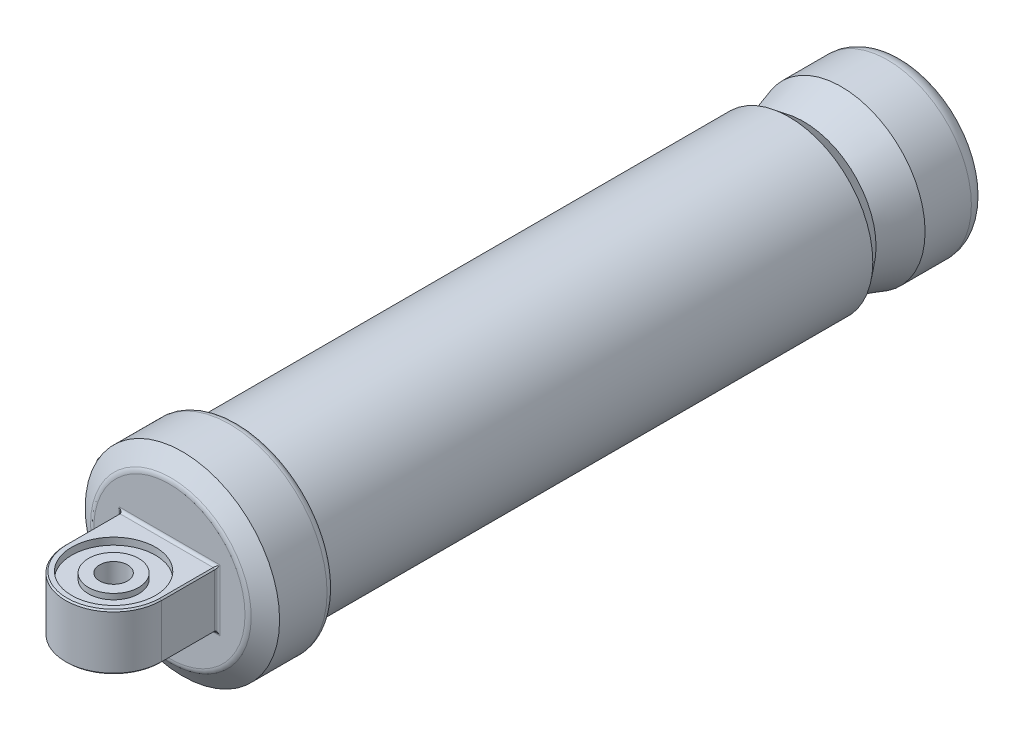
SolidWorks part; units mm, degrees
ref_plane "Front Plane" through (0, 0, 0) normal (0, 0, 1) x (1, 0, 0)
ref_plane "Top Plane" through (0, 0, 0) normal (0, 1, 0) x (1, 0, 0)
ref_plane "Right Plane" through (0, 0, 0) normal (1, 0, 0) x (0, 0, -1)
imported_body "Imported6"
sketch "Sketch1" plane through (0, 0, 66.8352) normal (0, 0, -1) x (-1, 0, 0)
  line L0 (34.5157, -4.5) -> (34.5157, 4.5)
  line L1 (34.5157, 4.5) -> (44.5, 4.5) construction
  arc A0 (34.5157, 4.5) -> (34.5157, -4.5) centre (0, 0) ccw
  dimension "D1" = 34.8078
  dimension "D2" = 9.9843
  dimension "D3" = 44.5
extrude "Cut-Extrude1" cut sketch "Sketch1" against normal blind 11.4794
sketch "Sketch2" plane through (-34.5157, 0, 0) normal (1, 0, 0) x (0, 0, -1)
  line L0 (-66.8352, -4.5) -> (-66.8352, 4.5)
  line L1 (-66.8352, 4.5) -> (-78.3146, 4.5)
  line L2 (-78.3146, 4.5) -> (-78.3146, -4.5)
  line L3 (-78.3146, -4.5) -> (-66.8352, -4.5)
  line L4 (-66.8352, 4.5) -> (-78.3146, 4.5) construction
  dimension "D1" = 11.4794
  dimension "D2" = 9
extrude "Cut-Extrude2" cut sketch "Sketch2" against normal blind 0.9843
sketch "Sketch3" plane through (0, 0, 78.3146) normal (0, 0, -1) x (-1, 0, 0)
  line L0 (35.5, -4.5) -> (34.5157, -4.5) construction
  circle A0 centre (0, 0) radius 34.8078
  dimension "D1" = 69.6157
  dimension "D2" = 35.5
  dimension "D3" = 4.5
extrude "Boss-Extrude1" add sketch "Sketch3" along normal blind 3.187
ref_plane "Plane1" through (0, -10, 0) normal (0, -1, 0) x (1, 0, 0)
sketch "Sketch4" plane through (0, -10, 0) normal (0, -1, 0) x (1, 0, 0)
  line L0 (-17.15, 99.7801) -> (17.15, 99.7801)
  line L1 (17.15, 99.7801) -> (17.15, 119.7801)
  line L2 (-17.15, 119.7801) -> (-17.15, 99.7801)
  line L3 (0, 119.7801) -> (0, 99.7801) construction
  line L4 (-17.15, 119.7801) -> (17.15, 119.7801) construction
  line L5 (0, -18.1197) -> (0, 18.1197) construction
  arc A0 (17.15, 119.7801) -> (-17.15, 119.7801) centre (0, 119.7801) ccw
  circle A1 centre (0, 119.7801) radius 5
  dimension "D1" = 17.15
  dimension "D3" = 10
  dimension "D2" = 20
extrude "Boss-Extrude2" add sketch "Sketch4" against normal blind 20
hole_wizard "M27 Clearance Hole1" positions "Sketch6" profile "Sketch5" hole size "M27" standard "Ansi Metric"
sketch "Sketch6" plane through (0, -10, 0) normal (0, -1, 0) x (1, 0, 0)
  point P0 (0, 119.7801)
sketch "Sketch5" plane through (0, -10, 119.7801) normal (1, 0, 0) x (0, 0, -1)
  line L0 (0, 0) -> (0, 2.5)
  line L1 (0, 2.5) -> (15, 2.5)
  line L2 (15, 2.5) -> (15, 0)
  line L5 (15, 0) -> (0, 0)
  line L10 (0, 2.5) -> (-15, 2.5) construction
  line L11 (0, -6.35) -> (0, 107.95) construction
  dimension "Hole Dia." = 30
  dimension "Hole Depth" = 2.5
  dimension "Drill Angle" = 180
sketch "Sketch7" plane through (0, -7.5, 0) normal (0, -1, 0) x (1, 0, 0)
  circle A0 centre (0, 119.7801) radius 10.5
  circle A1 centre (0, 119.7801) radius 15 construction
  dimension "D1" = 21
extrude "Boss-Extrude3" add sketch "Sketch7" along normal blind 1
mirror "Mirror1" about plane through (0, 0, 0) normal (0, 1, 0) of "Boss-Extrude3", "M27 Clearance Hole1"
hole_wizard "Ø20.0 (20) Diameter Hole1" positions "Sketch9" profile "Sketch8" hole size "Ø20.0" standard "Ansi Metric"
sketch "Sketch9" plane through (0, -8.5, 0) normal (0, -1, 0) x (1, 0, 0)
  point P0 (0, 119.7801)
sketch "Sketch8" plane through (0, -8.5, 119.7801) normal (1, 0, 0) x (0, 0, -1)
  line L0 (0, 0) -> (0, 1)
  line L1 (0, 1) -> (10, 1)
  line L2 (10, 1) -> (10, 0)
  line L5 (10, 0) -> (0, 0)
  line L10 (0, 1) -> (-10, 1) construction
  line L11 (0, -6.35) -> (0, 107.95) construction
  dimension "Hole Dia." = 20
  dimension "Hole Depth" = 1
  dimension "Drill Angle" = 180
hole_wizard "M27 Clearance Hole2" positions "Sketch11" profile "Sketch10" hole size "M27" standard "Ansi Metric"
sketch "Sketch11" plane through (0, 10, 0) normal (0, 1, 0) x (-1, 0, 0)
  point P0 (0, 119.7801)
sketch "Sketch10" plane through (0, 10, 119.7801) normal (1, 0, 0) x (0, 0, 1)
  line L0 (0, 0) -> (0, 2.5)
  line L1 (0, 2.5) -> (15, 2.5)
  line L2 (15, 2.5) -> (15, 0)
  line L5 (15, 0) -> (0, 0)
  line L10 (0, 2.5) -> (-15, 2.5) construction
  line L11 (0, -6.35) -> (0, 107.95) construction
  dimension "Hole Dia." = 30
  dimension "Hole Depth" = 2.5
  dimension "Drill Angle" = 180
draft "Draft1" type of draft neutral plane draft angle 54.524 faces to draft 1 parameters "D1"=54.524
ref_plane "Plane2" through (0, 0, 119.7801) normal (0, 0, -1) x (-1, 0, 0)
sketch "Sketch15" plane through (0, 0, 119.7801) normal (0, 0, -1) x (-1, 0, 0)
  line L0 (-9, 7.5) -> (0, 7.5)
  line L1 (0, 7.5) -> (0, 9.5)
  line L2 (0, 9.5) -> (-9, 9.5)
  line L3 (-9, 9.5) -> (-9, 7.5)
  line L4 (0, 7.5) -> (0, 9.5) construction
  dimension "D1" = 9
  dimension "D2" = 2
revolve "Revolve1" add sketch "Sketch15" angle 360 about L4
sketch "Sketch16" plane through (0, 0, 119.7801) normal (0, 0, -1) x (-1, 0, 0)
  line L0 (-9, -9.5) -> (0, -9.5)
  line L1 (0, -9.5) -> (0, -7.5)
  line L2 (0, -7.5) -> (-9, -7.5)
  line L3 (-9, -7.5) -> (-9, -9.5)
  line L4 (0, -9.5) -> (0, -7.5) construction
  dimension "D1" = 9
  dimension "D2" = 2
revolve "Revolve2" add sketch "Sketch16" angle 360 about L4
hole_wizard "Ø10.0 (10) Diameter Hole1" positions "Sketch18" profile "Sketch17" hole size "Ø10.0" standard "Ansi Metric"
sketch "Sketch18" plane through (0, 9.5, 0) normal (0, 1, 0) x (-1, 0, 0)
  point P0 (0, 119.7801)
sketch "Sketch17" plane through (0, 9.5, 119.7801) normal (1, 0, 0) x (0, 0, 1)
  line L0 (0, 0) -> (0, 44.3078)
  line L1 (0, 44.3078) -> (5, 44.3078)
  line L2 (5, 44.3078) -> (5, 0)
  line L5 (5, 0) -> (0, 0)
  line L11 (0, -6.35) -> (0, 107.95) construction
  dimension "Thru Hole Dia." = 10
  dimension "Thru Hole Depth" = 44.3078
fillet "Fillet1" radius 2 8 edges at (-39.5599, 4.5, 88.1253) (-44.5, 4.5, 74.0143) (-35.5, 4.5, 72.5749) (-35.0079, 4.5, 79.0052) (-35.0079, -4.5, 79.0052) (-35.5, -4.5, 72.5749) (-44.5, -4.5, 74.0143) (-39.5599, -4.5, 88.1253)
fillet "Fillet2" radius 3 2 edges at (-34.8078, 0, 75.1276) (28, 0, 99.7801)
sketch "Sketch19" plane through (0, 0, 0) normal (0, 1, 0) x (1, 0, 0)
  line L0 (22, -64.7801) -> (0, -64.7801)
  line L1 (0, -64.7801) -> (0, -75.1276)
  line L2 (0, -75.1276) -> (30, -75.1276)
  line L3 (30, -75.1276) -> (30, 122.1508)
  line L4 (30, 122.1508) -> (25.8694, 127.4459)
  line L5 (25.8694, 127.4459) -> (30, 140.8813)
  line L6 (30, 140.8813) -> (30, 157.4656)
  line L7 (21.8096, 165.2199) -> (22, 165.2199)
  line L8 (22, 165.2199) -> (22, -64.7801)
  line L9 (0, 165.2339) -> (0, -75.1276) construction
  arc A0 (30, 157.4656) -> (24.2581, 163.2074) centre (24.2581, 157.4656) ccw
  arc A1 (24.2581, 163.2074) -> (21.8096, 165.2199) centre (22.0581, 163.0264) ccw
  dimension "D1" = 5.7419
  dimension "D2" = 2.2075
  dimension "D3" = 21.8096
  dimension "D4" = 22
  dimension "D5" = 22.0581
  dimension "D6" = 25.8694
  dimension "D7" = 30
  dimension "D8" = 10.3475
  dimension "D9" = 197.2784
  dimension "D10" = 202.5735
  dimension "D11" = 216.0089
  dimension "D12" = 238.1541
revolve "Revolve3" add sketch "Sketch19" angle 360 about L9
fillet "Fillet3" radius 1 4 edges at (-17.15, 0, 99.7801) (0, -10, 99.7801) (17.15, 0, 99.7801) (0, 10, 99.7801)
chamfer "Chamfer1" distance 0.5 10 edges at (17.15, 10, 110.2801) (0, 10, 136.9301) (-17.15, 10, 110.2801) (17.15, -10, 110.2801) (-17.15, -10, 110.2801) (0, -10, 136.9301) (17.4429, 10.2929, 100.073) (-17.4429, 10.2929, 100.073) (17.4429, -10.2929, 100.073) (-17.4429, -10.2929, 100.073)
sketch "Sketch20" plane through (0, 0, 66.8352) normal (0, 0, -1) x (-1, 0, 0)
  line L1 (40, 4.5) -> (36.1029, 2.25)
  line L2 (36.1029, 2.25) -> (36.1029, -2.25)
  line L3 (36.1029, -2.25) -> (40, -4.5)
  line L4 (44.5, -2.5) -> (44.5, 2.5)
  line L5 (42.5, 4.5) -> (37.5, 4.5)
  line L6 (35.5, 2.5) -> (35.5, -2.5)
  line L7 (37.5, -4.5) -> (42.5, -4.5)
  line L8 (44.5, -2.5) -> (44.5, 2.5)
  line L9 (42.5, 4.5) -> (37.5, 4.5)
  line L10 (35.5, 2.5) -> (35.5, -2.5)
  line L11 (37.5, -4.5) -> (42.5, -4.5)
  line L12 (40, -4.5) -> (43.8971, -2.25)
  line L13 (43.8971, -2.25) -> (43.8971, 2.25)
  line L14 (43.8971, 2.25) -> (40, 4.5)
  circle A0 centre (40, 0) radius 3 construction
  circle A1 centre (40, 0) radius 3 construction
  circle A2 centre (40, 0) radius 3.8971 construction
  arc A4 (44.5, 2.5) -> (42.5, 4.5) centre (42.5, 2.5) ccw
  arc A5 (37.5, 4.5) -> (35.5, 2.5) centre (37.5, 2.5) ccw
  arc A6 (35.5, -2.5) -> (37.5, -4.5) centre (37.5, -2.5) ccw
  arc A7 (42.5, -4.5) -> (44.5, -2.5) centre (42.5, -2.5) ccw
  arc A8 (44.5, 2.5) -> (42.5, 4.5) centre (42.5, 2.5) ccw
  arc A9 (37.5, 4.5) -> (35.5, 2.5) centre (37.5, 2.5) ccw
  arc A10 (35.5, -2.5) -> (37.5, -4.5) centre (37.5, -2.5) ccw
  arc A11 (42.5, -4.5) -> (44.5, -2.5) centre (42.5, -2.5) ccw
  dimension "D1" = 0
extrude "Boss-Extrude5" add sketch "Sketch20" along normal blind 2 separate body contours L13 L14 L1 L2 L3 L12 M9
sketch "Sketch21" plane through (0, 0, 0) normal (0, 1, 0) x (1, 0, 0)
  line L0 (-40, -66.8352) -> (-40, -49.2228) construction
  line L1 (-40, -64.8352) -> (-36.1029, -64.8352) construction
  line L2 (-40, -49.2228) -> (-39, -49.2228)
  line L3 (-40, -49.2228) -> (-40, -64.8352)
  line L4 (-40, -64.8352) -> (-37, -64.8352)
  line L5 (-37, -51.2228) -> (-37, -64.8352)
  arc A0 (-39, -49.2228) -> (-37, -51.2228) centre (-39, -51.2228) cw
  dimension "D1" = 2
  dimension "D2" = 3
revolve "Revolve4" add sketch "Sketch21" angle 360 about L0
sketch "Sketch22" plane through (0, 0, 0) normal (0, 1, 0) x (1, 0, 0)
  line L0 (-40, -49.2228) -> (-40, -68.6306) construction
  line L1 (-39, -49.2228) -> (-41, -49.2228) construction
  circle A0 centre (-43, -51.2228) radius 0.3029
sketch "Sketch23" plane through (0, 0, 0) normal (0, 1, 0) x (1, 0, 0)
  line L0 (-40, -51.2228) -> (-40, -64.8352)
  line L1 (-37, -51.2228) -> (-43, -51.2228) construction
  line L2 (-43.8971, -64.8352) -> (-40, -64.8352) construction
sweep "Cut-Sweep1" cut profiles "Sketch22" path "Sketch23" parameters "D1"=7200
